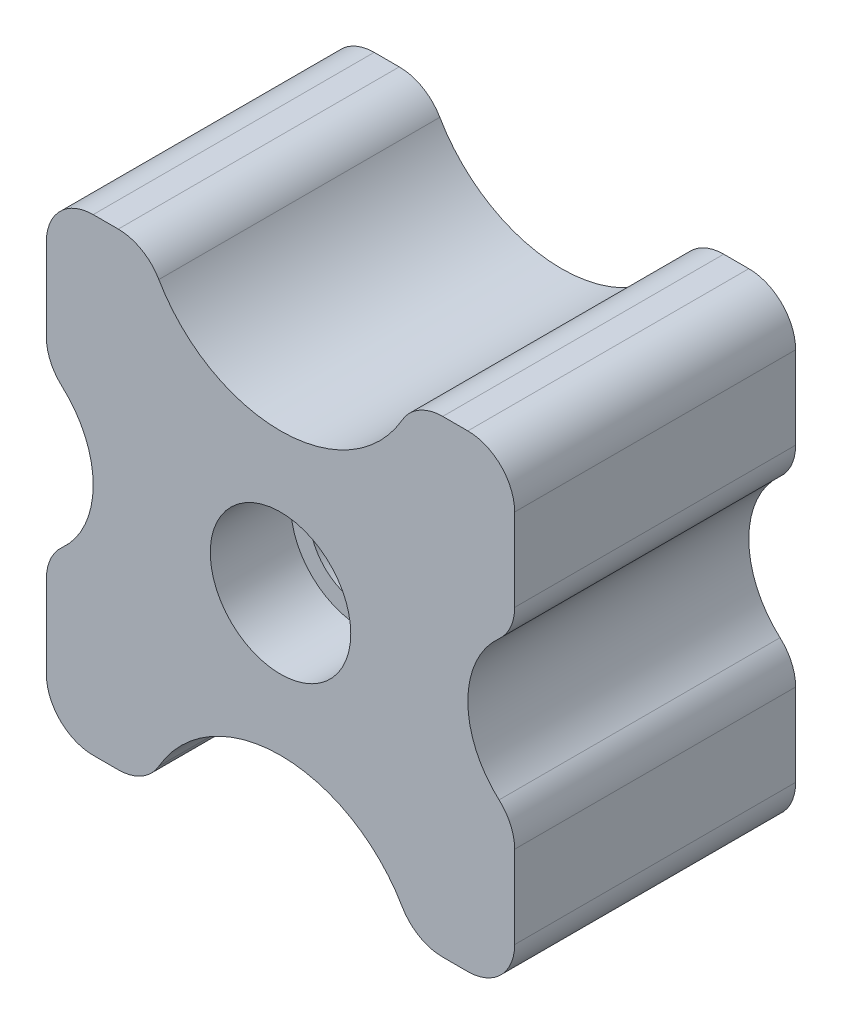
SolidWorks part; units mm, degrees
ref_plane "Ebene vorne" through (0, 0, 0) normal (0, 0, 1) x (1, 0, 0)
ref_plane "Ebene oben" through (0, 0, 0) normal (0, 1, 0) x (1, 0, 0)
ref_plane "Ebene rechts" through (0, 0, 0) normal (1, 0, 0) x (0, 0, -1)
sketch "Skizze1" plane through (0, 0, 0) normal (0, 0, 1) x (1, 0, 0)
  line L1 (-25, 25) -> (25, 25)
  line L2 (-25, 25) -> (-25, -25)
  line L3 (-25, -25) -> (25, -25)
  line L4 (25, 25) -> (25, -25)
  line L5 (-25, 25) -> (25, -25) construction
  line L6 (-25, -25) -> (25, 25) construction
  point P0 (0, 0)
  dimension "D1" = 50
  dimension "D2" = 50
extrude "Aufsatz-Linear austragen1" add sketch "Skizze1" along normal blind 30
sketch "Skizze2" plane through (0, 0, 0) normal (0, 0, 1) x (1, 0, 0)
  line L0 (-25, 0) -> (25, 0) construction
  line L1 (-25, 25) -> (-25, -25) construction
  line L2 (25, -25) -> (25, 25) construction
  line L3 (0, -25) -> (0, 25) construction
  line L4 (-25, -25) -> (25, -25) construction
  line L5 (25, 25) -> (-25, 25) construction
  circle A0 centre (-30, 0) radius 10
  circle A1 centre (0, -30) radius 15
  circle A2 centre (30, 0) radius 10
  circle A3 centre (0, 30) radius 15
  dimension "D1" = 30
  dimension "D2" = 30
extrude "Schnitt-Linear austragen2" cut sketch "Skizze2" along normal up to surface (30 mm away)
fillet "Verrundung1" radius 5 12 edges at (25, -25, 15) (25, 8.6603, 15) (25, -8.6603, 15) (-25, -25, 15) (-25, -8.6603, 15) (-25, 8.6603, 15) (-25, 25, 15) (-14.1421, 25, 15) (14.1421, 25, 15) (25, 25, 15) (14.1421, -25, 15) (-14.1421, -25, 15)
hole_wizard "Stirnsenkung für M8 Zylinderschraube mit Innensechskant1" positions "Skizze4" profile "Skizze3" counterbore size "M8" standard "DIN"
sketch "Skizze4" plane through (0, 0, 30) normal (0, 0, 1) x (1, 0, 0)
  point P0 (0, 0)
sketch "Skizze3" plane through (0, 0, 30) normal (1, 0, 0) x (0, -1, 0)
  line L0 (0, 0) -> (0, 30)
  line L1 (0, 30) -> (5.5, 30)
  line L3 (5.5, 30) -> (5.5, 8.6)
  line L4 (5.5, 8.6) -> (7.5, 8.6)
  line L5 (7.5, 8.6) -> (7.5, 0)
  line L7 (7.5, 0) -> (0, 0)
  line L11 (0, -6.35) -> (0, 107.95) construction
  dimension "Bohrerdurchmesser" = 11
  dimension "Bohrungstiefe" = 30
  dimension "Senkdurchmesser2" = 15
  dimension "Senktiefe2" = 8.6
